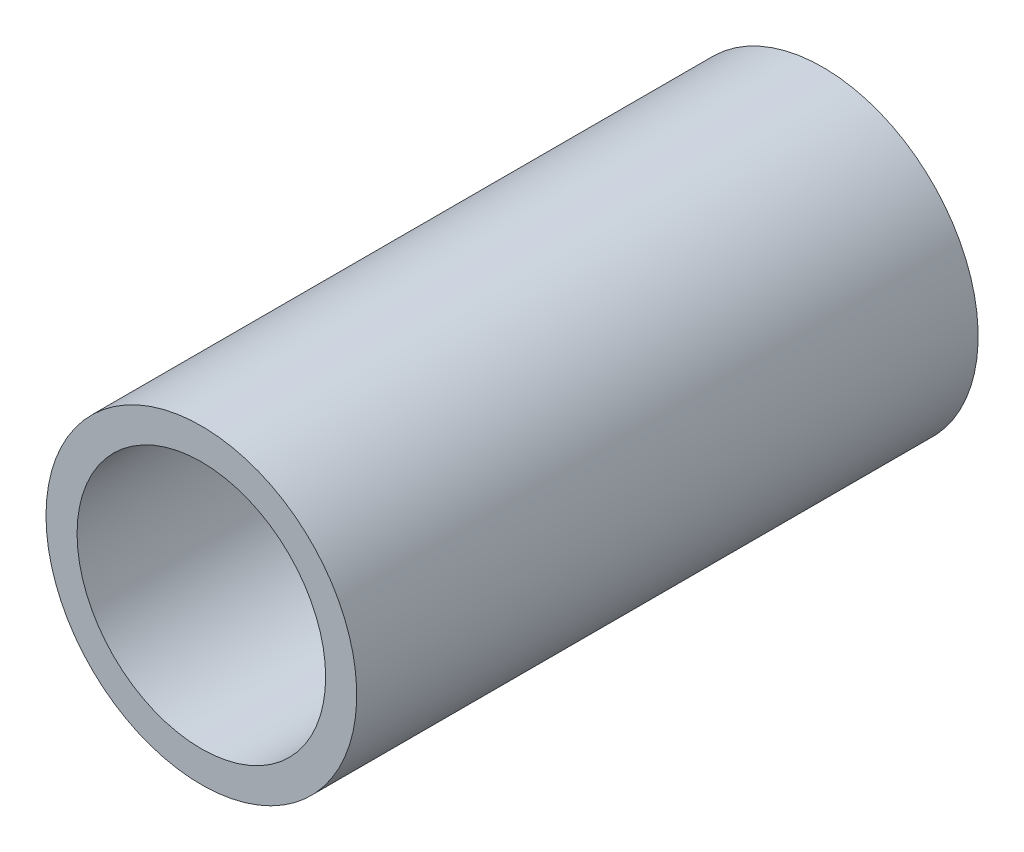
SolidWorks part; units mm, degrees
ref_plane "Plan de face" through (0, 0, 0) normal (0, 0, 1) x (1, 0, 0)
ref_plane "Plan de dessus" through (0, 0, 0) normal (0, 1, 0) x (1, 0, 0)
ref_plane "Plan de droite" through (0, 0, 0) normal (1, 0, 0) x (0, 0, -1)
sketch "Esquisse1" plane through (0, 0, 0) normal (0, 0, 1) x (1, 0, 0)
  circle A0 centre (0, 0) radius 50
  circle A1 centre (0, 0) radius 40
  point P4 (40, 0)
  point P5 (50, 0)
  dimension "D1" = 100
  dimension "D2" = 80
  dimension "D3" = 10
extrude "Extrusion1" add sketch "Esquisse1" along normal blind 200
